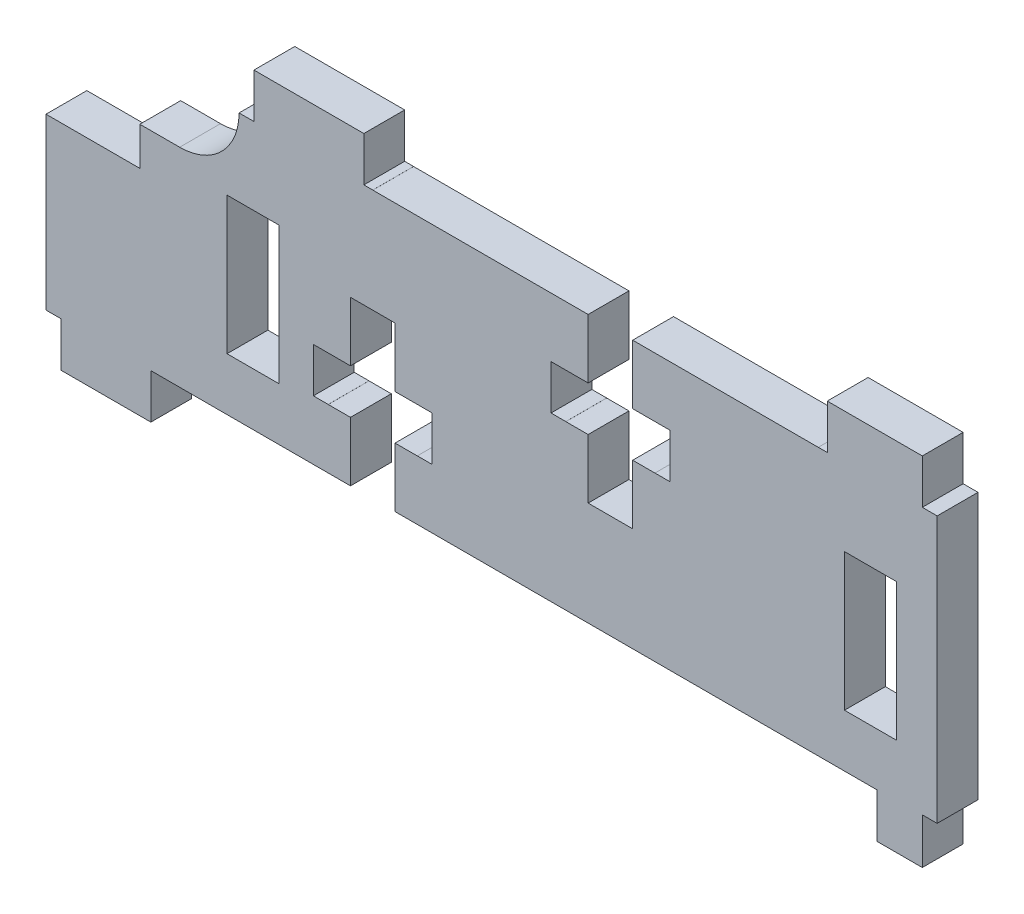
SolidWorks part; units mm, degrees
ref_plane "Front Plane" through (0, 0, 0) normal (0, 0, 1) x (1, 0, 0)
ref_plane "Top Plane" through (0, 0, 0) normal (0, 1, 0) x (1, 0, 0)
ref_plane "Right Plane" through (0, 0, 0) normal (1, 0, 0) x (0, 0, -1)
imported_body "Imported1"
sketch "Sketch2" plane through (0, 0, 0) normal (0, 0, 1) x (1, 0, 0)
  line L1 (-62.08, -3.55) -> (-13.2, -3.55)
  line L2 (-62.08, -3.55) -> (-62.08, -6.6)
  line L3 (-62.08, -6.6) -> (-13.2, -6.6)
  line L4 (-13.2, -3.55) -> (-13.2, -6.6)
extrude "Cut-Extrude1" cut sketch "Sketch2" along normal blind 3
sketch "Sketch3" plane through (0, 0, 0) normal (0, 0, 1) x (1, 0, 0)
  line L1 (-47.74, 17.45) -> (-16.54, 17.45)
  line L2 (-47.74, 17.45) -> (-47.74, 14.45)
  line L3 (-47.74, 14.45) -> (-16.54, 14.45)
  line L4 (-16.54, 17.45) -> (-16.54, 14.45)
extrude "Cut-Extrude2" cut sketch "Sketch3" along normal blind 3
sketch "Sketch4" plane through (0, 0, 0) normal (0, 0, 1) x (1, 0, 0)
  line L1 (-56.1404, 17.4466) -> (-55.1404, 17.4466)
  line L2 (-56.1404, 17.4466) -> (-56.1404, 14.4466)
  line L3 (-56.1404, 14.4466) -> (-55.1404, 14.4466)
  line L4 (-55.1404, 17.4466) -> (-55.1404, 14.4466)
  line L5 (-9.1404, 17.4466) -> (-10.1404, 17.4466)
  line L6 (-9.1404, 17.4466) -> (-9.1404, 14.45)
  line L7 (-9.1404, 14.45) -> (-10.1404, 14.45)
  line L8 (-10.1404, 17.4466) -> (-10.1404, 14.45)
  line L9 (-9.1404, -6.5534) -> (-10.1404, -6.5534)
  line L10 (-9.1404, -6.5534) -> (-9.1404, -3.4786)
  line L11 (-9.1404, -3.4786) -> (-10.1404, -3.4786)
  line L12 (-10.1404, -6.5534) -> (-10.1404, -3.4786)
  line L13 (-69.1404, -6.5534) -> (-68.1404, -6.5534)
  line L14 (-69.1404, -6.5534) -> (-69.1404, -3.55)
  line L15 (-69.1404, -3.55) -> (-68.1404, -3.55)
  line L16 (-68.1404, -6.5534) -> (-68.1404, -3.55)
extrude "Cut-Extrude3" cut sketch "Sketch4" along normal blind 3
sketch "Sketch5" plane through (0, 0, 0) normal (0, 0, 1) x (1, 0, 0)
  line L1 (-51.14, 3.45) -> (-43.14, 3.45)
  line L2 (-51.14, 3.45) -> (-51.14, 0.45)
  line L3 (-51.14, 0.45) -> (-43.14, 0.45)
  line L4 (-43.14, 3.45) -> (-43.14, 0.45)
  line L5 (-35.14, 10.45) -> (-27.14, 10.45)
  line L6 (-35.14, 10.45) -> (-35.14, 7.45)
  line L7 (-35.14, 7.45) -> (-27.14, 7.45)
  line L8 (-27.14, 10.45) -> (-27.14, 7.45)
extrude "Cut-Extrude4" cut sketch "Sketch5" along normal blind 3
sketch "Sketch6" plane through (0, 0, 0) normal (1, 0, 0) x (0, 0, -1)
  line L0 (-3, -6.5534) -> (0, -6.5534) construction
  line L1 (-3, 17.4466) -> (-2.75, 17.4466)
  line L2 (-3, 17.4466) -> (-3, -6.5534)
  line L3 (-3, -6.5534) -> (-2.75, -6.5534)
  line L4 (-2.75, 17.4466) -> (-2.75, -6.5534)
extrude "Cut-Extrude5" cut sketch "Sketch6" against normal blind 100
sketch "Sketch8" plane through (0, 0, 2.75) normal (0, 0, 1) x (1, 0, 0)
  line L1 (-69.1404, 10.4466) -> (-62.8233, 10.4466)
  line L2 (-69.1404, 10.4466) -> (-69.1404, 7.8736)
  line L3 (-69.1404, 7.8736) -> (-62.8233, 7.8736)
  line L4 (-62.8233, 10.4466) -> (-62.8233, 7.8736)
  line L5 (-56.9515, 9.25) -> (-53.4515, 9.25)
  line L6 (-56.9515, 9.25) -> (-56.9515, 0)
  line L7 (-56.9515, 0) -> (-53.4515, 0)
  line L8 (-53.4515, 9.25) -> (-53.4515, 0)
  line L9 (-15.3792, 9.25) -> (-11.8792, 9.25)
  line L10 (-15.3792, 9.25) -> (-15.3792, 0)
  line L11 (-15.3792, 0) -> (-11.8792, 0)
  line L12 (-11.8792, 9.25) -> (-11.8792, 0)
extrude "Cut-Extrude6" cut sketch "Sketch8" against normal blind 3
